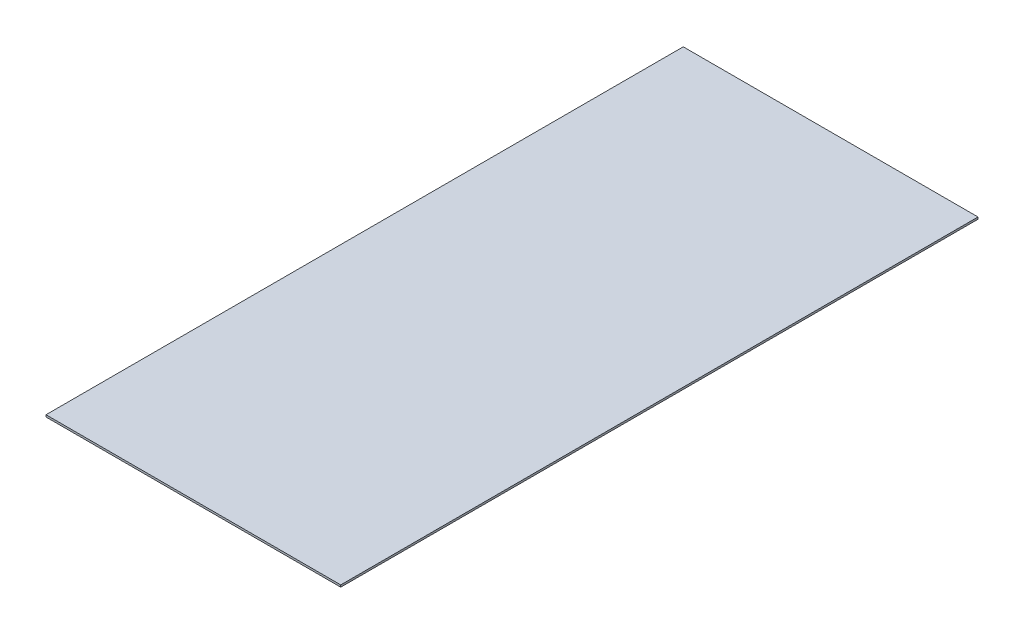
SolidWorks part; units mm, degrees
ref_plane "FRONT" through (0, 0, 0) normal (0, 0, 1) x (1, 0, 0)
ref_plane "TOP" through (0, 0, 0) normal (0, 1, 0) x (1, 0, 0)
ref_plane "RIGHT" through (0, 0, 0) normal (1, 0, 0) x (0, 0, -1)
sketch "Sketch1" plane through (0, 0, 0) normal (0, 1, 0) x (1, 0, 0)
  line L1 (-352.425, 762) -> (352.425, 762)
  line L2 (-352.425, 762) -> (-352.425, -762)
  line L3 (-352.425, -762) -> (352.425, -762)
  line L4 (352.425, 762) -> (352.425, -762)
  line L5 (-352.425, 762) -> (352.425, -762) construction
  line L6 (-352.425, -762) -> (352.425, 762) construction
  point P0 (0, 0)
  dimension "D1" = 704.85
  dimension "D2" = 1524
extrude "Boss-Extrude1" add sketch "Sketch1" along normal blind 4.7625
